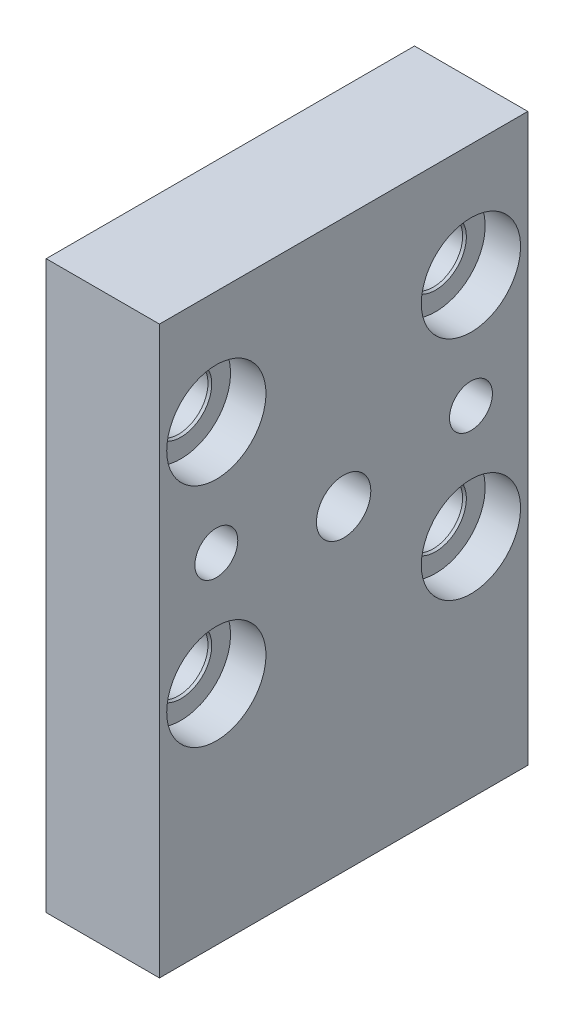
SolidWorks part; units mm, degrees
ref_plane "Front Plane" through (0, 0, 0) normal (0, 0, 1) x (1, 0, 0)
ref_plane "Top Plane" through (0, 0, 0) normal (0, 1, 0) x (1, 0, 0)
ref_plane "Right Plane" through (0, 0, 0) normal (1, 0, 0) x (0, 0, -1)
sketch "Sketch1" plane through (0, 0, 0) normal (1, 0, 0) x (0, 0, -1)
  line L0 (-10.3251, 0) -> (10.3251, 0)
  line L1 (10.3251, 0) -> (10.3251, 31.75)
  line L2 (10.3251, 31.75) -> (-10.3251, 31.75)
  line L3 (-10.3251, 31.75) -> (-10.3251, 0)
  circle A0 centre (7.1374, 19.05) radius 1.2027
  circle A1 centre (0, 17.7292) radius 1.524
  circle A2 centre (-7.1374, 19.05) radius 1.2027
extrude "Extrude1" add sketch "Sketch1" along normal blind 6.35
ref_plane "Plane1" through (0, 0, 7.1374) normal (0, 0, 1) x (1, 0, 0)
sketch "Sketch2" plane through (0, 0, 7.1374) normal (0, 0, 1) x (1, 0, 0)
  line L0 (0, 25.4) -> (0, 27.051)
  line L1 (0, 27.051) -> (4.2333, 27.051)
  line L2 (4.2333, 27.051) -> (4.3653, 27.1272)
  line L3 (4.3653, 27.1272) -> (4.3653, 28.1813)
  line L4 (4.3653, 28.1813) -> (6.35, 28.1813)
  line L5 (6.35, 28.1813) -> (6.35, 25.4)
  line L6 (6.35, 25.4) -> (0, 25.4)
  line L7 (6.35, 25.4) -> (0, 25.4) construction
revolve "Cut-Revolve1" cut sketch "Sketch2" angle 360 about L7
ref_plane "Plane2" through (0, 0, -7.1374) normal (0, 0, 1) x (1, 0, 0)
ref_plane "Plane3" through (0, 0, 7.1374) normal (0, 0, 1) x (1, 0, 0)
ref_plane "Plane4" through (0, 0, -7.1374) normal (0, 0, 1) x (1, 0, 0)
sketch "Sketch3" plane through (0, 0, -7.1374) normal (0, 0, 1) x (1, 0, 0)
  line L0 (0, 12.7) -> (0, 14.351)
  line L1 (0, 14.351) -> (4.2333, 14.351)
  line L2 (4.2333, 14.351) -> (4.3653, 14.4272)
  line L3 (4.3653, 14.4272) -> (4.3653, 15.4813)
  line L4 (4.3653, 15.4813) -> (6.35, 15.4813)
  line L5 (6.35, 15.4813) -> (6.35, 12.7)
  line L6 (6.35, 12.7) -> (0, 12.7)
  line L7 (6.35, 12.7) -> (0, 12.7) construction
sketch "Sketch4" plane through (0, 0, 7.1374) normal (0, 0, 1) x (1, 0, 0)
  line L0 (0, 12.7) -> (0, 14.351)
  line L1 (0, 14.351) -> (4.2333, 14.351)
  line L2 (4.2333, 14.351) -> (4.3653, 14.4272)
  line L3 (4.3653, 14.4272) -> (4.3653, 15.4813)
  line L4 (4.3653, 15.4813) -> (6.35, 15.4813)
  line L5 (6.35, 15.4813) -> (6.35, 12.7)
  line L6 (6.35, 12.7) -> (0, 12.7)
  line L7 (6.35, 12.7) -> (0, 12.7) construction
sketch "Sketch5" plane through (0, 0, -7.1374) normal (0, 0, 1) x (1, 0, 0)
  line L0 (0, 25.4) -> (0, 27.051)
  line L1 (0, 27.051) -> (4.2333, 27.051)
  line L2 (4.2333, 27.051) -> (4.3653, 27.1272)
  line L3 (4.3653, 27.1272) -> (4.3653, 28.1813)
  line L4 (4.3653, 28.1813) -> (6.35, 28.1813)
  line L5 (6.35, 28.1813) -> (6.35, 25.4)
  line L6 (6.35, 25.4) -> (0, 25.4)
  line L7 (6.35, 25.4) -> (0, 25.4) construction
revolve "Cut-Revolve2" cut sketch "Sketch3" angle 360 about L7
revolve "Cut-Revolve3" cut sketch "Sketch4" angle 360 about L7
revolve "Cut-Revolve4" cut sketch "Sketch5" angle 360 about L7
sketch "Sketch6" plane through (0, 0, 0) normal (1, 0, 0) x (0, 0, -1)
  circle A0 centre (0, 7.5692) radius 2.7432
extrude "Cut-Extrude1" cut sketch "Sketch6" along normal blind 3.175
sketch "Sketch7" plane through (0, 0, 0) normal (1, 0, 0) x (0, 0, -1)
  circle A0 centre (0, 22.8346) radius 2.7432
sketch "Sketch8" plane through (0, 0, 0) normal (1, 0, 0) x (0, 0, -1)
  circle A0 centre (0, 28.4226) radius 2.7432
extrude "Cut-Extrude2" cut sketch "Sketch7" along normal blind 3.175
extrude "Cut-Extrude3" cut sketch "Sketch8" along normal blind 3.175
sketch "Sketch9" plane through (0, 0, 0) normal (0, 0, 1) x (1, 0, 0)
  line L0 (0, 7.5692) -> (0, 9.6012)
  line L1 (0.508, 10.1092) -> (3.175, 10.1092)
  line L2 (3.175, 10.1092) -> (3.175, 7.5692)
  line L3 (3.175, 7.5692) -> (0, 7.5692)
  line L4 (3.175, 7.5692) -> (0, 7.5692) construction
  arc A0 (0, 9.6012) -> (0.508, 10.1092) centre (0.508, 9.6012) cw
revolve "Revolve1" add sketch "Sketch9" angle 360 about L4
ref_plane "Plane5" through (3.175, 0, 0) normal (1, 0, 0) x (0, 0, -1)
ref_plane "Plane6" through (0, 0, 0) normal (0, 0, 1) x (1, 0, 0)
ref_plane "Plane7" through (0, 0, 0) normal (0, 0, 1) x (1, 0, 0)
sketch "Sketch10" plane through (0, 0, 0) normal (0, 0, 1) x (1, 0, 0)
  line L0 (0, 28.4226) -> (0, 30.4546)
  line L1 (0.508, 30.9626) -> (3.175, 30.9626)
  line L2 (3.175, 30.9626) -> (3.175, 28.4226)
  line L3 (3.175, 28.4226) -> (0, 28.4226)
  line L4 (3.175, 28.4226) -> (0, 28.4226) construction
  arc A0 (0, 30.4546) -> (0.508, 30.9626) centre (0.508, 30.4546) cw
sketch "Sketch11" plane through (0, 0, 0) normal (0, 0, 1) x (1, 0, 0)
  line L0 (0, 22.8346) -> (0, 24.8666)
  line L1 (0.508, 25.3746) -> (3.175, 25.3746)
  line L2 (3.175, 25.3746) -> (3.175, 22.8346)
  line L3 (3.175, 22.8346) -> (0, 22.8346)
  line L4 (3.175, 22.8346) -> (0, 22.8346) construction
  arc A0 (0, 24.8666) -> (0.508, 25.3746) centre (0.508, 24.8666) cw
revolve "Revolve2" add sketch "Sketch10" angle 360 about L4
revolve "Revolve3" add sketch "Sketch11" angle 360 about L4
sketch "Sketch12" plane through (0, 0, 0) normal (1, 0, 0) x (0, 0, -1)
  line L0 (-1.5875, 8.4857) -> (-1.5875, 6.6527)
  line L1 (-1.5875, 6.6527) -> (0, 5.7361)
  line L2 (0, 5.7361) -> (1.5875, 6.6527)
  line L3 (1.5875, 6.6527) -> (1.5875, 8.4857)
  line L4 (1.5875, 8.4857) -> (0, 9.4023)
  line L5 (0, 9.4023) -> (-1.5875, 8.4857)
extrude "Cut-Extrude4" cut sketch "Sketch12" along normal blind 1.5875
sketch "Sketch13" plane through (0, 0, 0) normal (1, 0, 0) x (0, 0, -1)
  line L0 (-1.5875, 29.3391) -> (-1.5875, 27.5061)
  line L1 (-1.5875, 27.5061) -> (0, 26.5895)
  line L2 (0, 26.5895) -> (1.5875, 27.5061)
  line L3 (1.5875, 27.5061) -> (1.5875, 29.3391)
  line L4 (1.5875, 29.3391) -> (0, 30.2557)
  line L5 (0, 30.2557) -> (-1.5875, 29.3391)
sketch "Sketch14" plane through (0, 0, 0) normal (1, 0, 0) x (0, 0, -1)
  line L0 (-1.5875, 23.7511) -> (-1.5875, 21.9181)
  line L1 (-1.5875, 21.9181) -> (0, 21.0015)
  line L2 (0, 21.0015) -> (1.5875, 21.9181)
  line L3 (1.5875, 21.9181) -> (1.5875, 23.7511)
  line L4 (1.5875, 23.7511) -> (0, 24.6677)
  line L5 (0, 24.6677) -> (-1.5875, 23.7511)
extrude "Cut-Extrude5" cut sketch "Sketch13" along normal blind 1.5875
extrude "Cut-Extrude6" cut sketch "Sketch14" along normal blind 1.5875
ref_plane "Plane8" through (6.35, 0, 0) normal (1, 0, 0) x (0, 0, -1)
